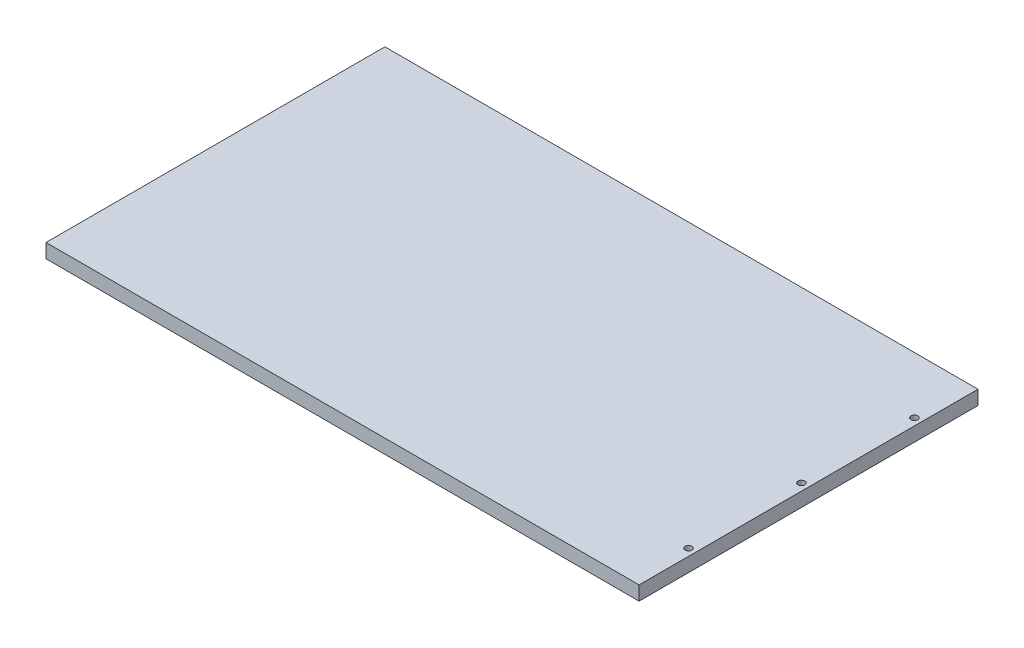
SolidWorks part; units mm, degrees
ref_plane "Front Plane" through (0, 0, 0) normal (0, 0, 1) x (1, 0, 0)
ref_plane "Top Plane" through (0, 0, 0) normal (0, 1, 0) x (1, 0, 0)
ref_plane "Right Plane" through (0, 0, 0) normal (1, 0, 0) x (0, 0, -1)
sketch "Sketch1" plane through (0, 0, 0) normal (0, 1, 0) x (1, 0, 0)
  line L1 (-133.35, -76.2) -> (133.35, -76.2)
  line L2 (-133.35, -76.2) -> (-133.35, 76.2)
  line L3 (-133.35, 76.2) -> (133.35, 76.2)
  line L4 (133.35, -76.2) -> (133.35, 76.2)
  line L5 (-133.35, -76.2) -> (133.35, 76.2) construction
  line L6 (-133.35, 76.2) -> (133.35, -76.2) construction
  point P0 (0, 0)
extrude "Boss-Extrude1" add sketch "Sketch1" along normal blind 6.35
hole_wizard "#4-40 Tapped Hole1" positions "Sketch4" profile "Sketch5" tap size "#4-40" standard "ANSI Inch"
sketch "Sketch4" plane through (-133.35, 0, 0) normal (-1, 0, 0) x (0, 0, 1)
  point P0 (0, 3.175)
  point P2 (-50.8, 3.175)
  point P4 (50.8, 3.175)
  dimension "D1" = 50.8
  dimension "D2" = 50.8
  dimension "D3" = 0
  dimension "D4" = 3.175
sketch "Sketch5" plane through (-133.35, 3.175, 0) normal (0, 1, 0) x (0, 0, 1)
  line L0 (0, 0) -> (0, 8.2992)
  line L1 (0, 8.2992) -> (1.1303, 7.62)
  line L2 (1.1303, 7.62) -> (1.1303, 0)
  line L5 (1.1303, 0) -> (0, 0)
  line L10 (0, 8.2992) -> (-1.1303, 7.62) construction
  line L11 (0, -6.35) -> (0, 107.95) construction
  dimension "Tap Drill Dia." = 2.2606
  dimension "Tap Drill Depth" = 7.62
  dimension "Drill Angle" = 118
hole_wizard "#31 (0.12) Diameter Hole1" positions "Sketch6" profile "Sketch8" hole size "#31" standard "ANSI Inch"
sketch "Sketch6" plane through (0, 6.35, 0) normal (0, 1, 0) x (1, 0, 0)
  line L0 (133.35, 76.2) -> (-133.35, 76.2) construction
  line L1 (133.35, -76.2) -> (133.35, 76.2) construction
  point P0 (130.175, 0)
  point P2 (130.175, 50.8)
  point P4 (130.175, -50.8)
  dimension "D1" = 50.8
  dimension "D2" = 50.8
  dimension "D3" = 76.2
  dimension "D4" = 3.175
sketch "Sketch8" plane through (130.175, 6.35, 0) normal (1, 0, 0) x (0, 0, 1)
  line L0 (0, 0) -> (0, 6.35)
  line L1 (0, 6.35) -> (1.524, 6.35)
  line L2 (1.524, 6.35) -> (1.524, 0)
  line L5 (1.524, 0) -> (0, 0)
  line L11 (0, -6.35) -> (0, 107.95) construction
  dimension "Thru Hole Dia." = 3.048
  dimension "Thru Hole Depth" = 6.35
